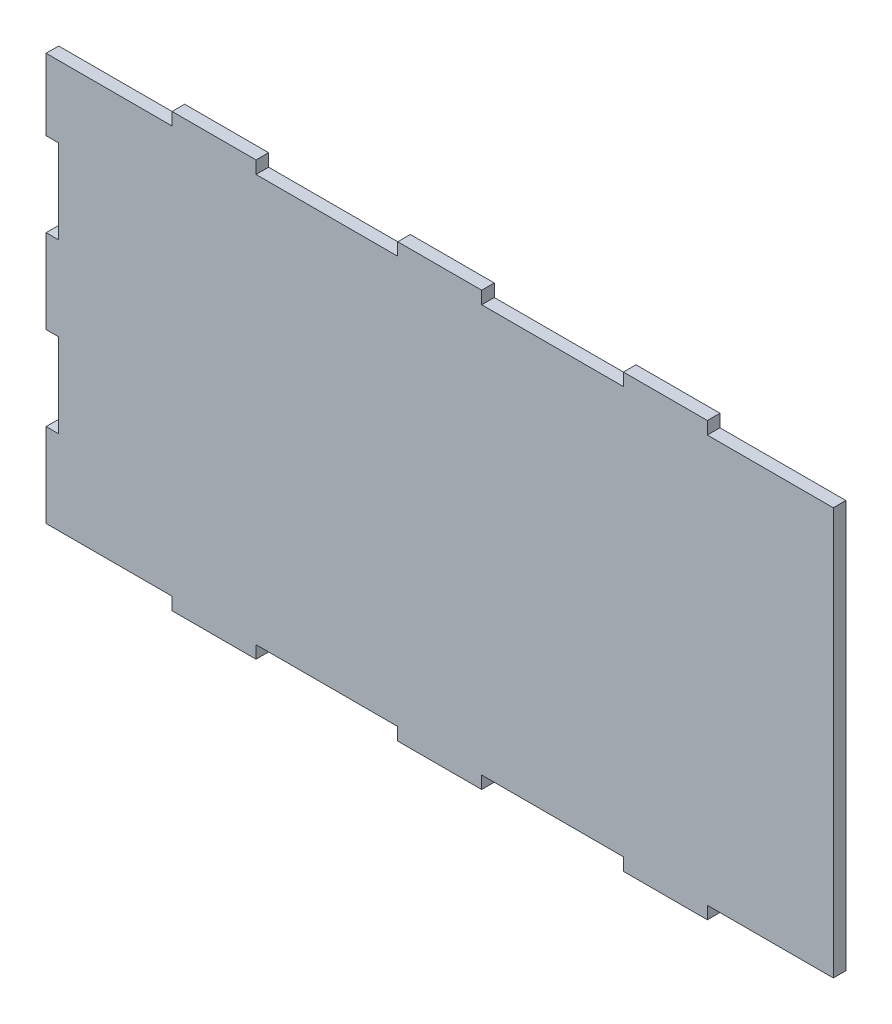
SolidWorks part; units mm, degrees
ref_plane "Alzado" through (0, 0, 0) normal (0, 0, 1) x (1, 0, 0)
ref_plane "Planta" through (0, 0, 0) normal (0, 1, 0) x (1, 0, 0)
ref_plane "Vista lateral" through (0, 0, 0) normal (1, 0, 0) x (0, 0, -1)
sketch "Croquis1" plane through (0, 0, 0) normal (0, 0, 1) x (1, 0, 0)
  line L0 (-175, -206) -> (-255, -206)
  line L1 (255, -206) -> (175, -206)
  line L2 (375, -194) -> (375, 194)
  line L3 (255, 206) -> (175, 206)
  line L4 (-375, -194) -> (-375, -114)
  line L5 (-375, 126) -> (-375, 194)
  line L6 (-375, 126) -> (-363, 126)
  line L8 (-175, -206) -> (-175, -194)
  line L9 (-175, -194) -> (-40, -194)
  line L10 (-40, -206) -> (-40, -194)
  line L12 (40, -206) -> (40, -194)
  line L13 (40, -194) -> (175, -194)
  line L14 (175, -206) -> (175, -194)
  line L16 (255, -206) -> (255, -194)
  line L17 (255, -194) -> (375, -194)
  line L19 (-375, -194) -> (-255, -194)
  line L22 (-255, -194) -> (-255, -206)
  line L23 (40, -206) -> (-40, -206)
  line L24 (-375, 6) -> (375, 6) construction
  line L26 (-375, 46) -> (-363, 46)
  line L27 (-363, 126) -> (-363, 46)
  line L28 (-375, -34) -> (-363, -34)
  line L30 (-375, -114) -> (-363, -114)
  line L31 (-363, -34) -> (-363, -114)
  line L32 (-375, -34) -> (-375, 46)
  line L33 (40, 206) -> (-40, 206)
  line L37 (-175, 206) -> (-255, 206)
  line L40 (-175, 206) -> (-175, 194)
  line L41 (-175, 194) -> (-40, 194)
  line L42 (-40, 206) -> (-40, 194)
  line L44 (40, 206) -> (40, 194)
  line L45 (40, 194) -> (175, 194)
  line L46 (175, 206) -> (175, 194)
  line L48 (255, 206) -> (255, 194)
  line L49 (255, 194) -> (375, 194)
  line L52 (-255, 206) -> (-255, 194)
  line L53 (-255, 194) -> (-375, 194)
  point P0 (0, 0)
  point P2 (0, 206)
  dimension "D2" = 388
  dimension "D3" = 12
  dimension "D4" = 135
  dimension "D5" = 135
  dimension "D6" = 80
  dimension "D7" = 120
  dimension "D8" = 120
  dimension "D9" = 80
  dimension "D10" = 12
  dimension "D11" = 750
  dimension "D12" = 12
  dimension "D13" = 80
  dimension "D14" = 80
  dimension "D15" = 80
  dimension "D16" = 80
extrude "Saliente-Extruir1" add sketch "Croquis1" along normal blind 12
